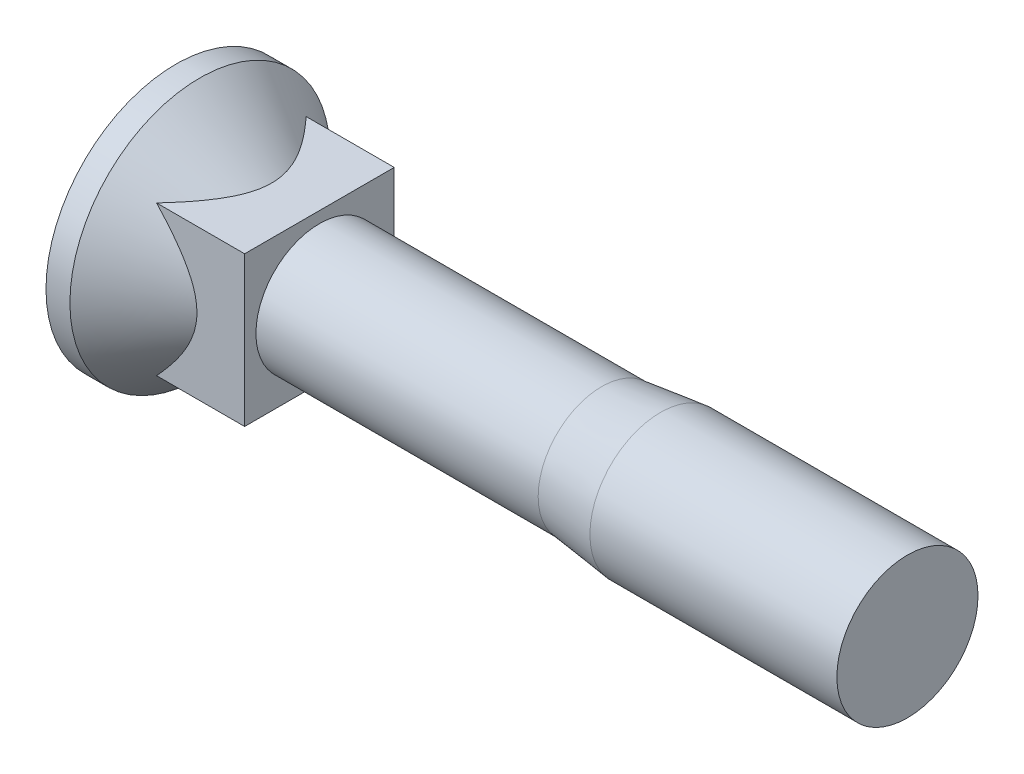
SolidWorks part; units mm, degrees
ref_plane "Front" through (0, 0, 0) normal (0, 0, 1) x (1, 0, 0)
ref_plane "Top" through (0, 0, 0) normal (0, 1, 0) x (1, 0, 0)
ref_plane "Right" through (0, 0, 0) normal (1, 0, 0) x (0, 0, -1)
ref_plane "Plane1" through (6.1, 0, 0) normal (1, 0, 0) x (0, 0, -1)
sketch "Sketch1" plane through (0, 0, 0) normal (0, 0, 1) x (1, 0, 0)
  line L0 (-5.3098, 0) -> (7.9048, 0) construction
  line L1 (0, 5.525) -> (0, 0)
  line L2 (0, 5.525) -> (1.0167, 5.525)
  line L3 (1.0167, 5.525) -> (7.5545, 0.5083)
  line L4 (7.5545, 0.5083) -> (7.5545, 0)
  line L5 (0, 0) -> (7.5545, 0)
  dimension "D1" = 37.5
  dimension "D2" = 1.0167
  dimension "D3" = 0.5083
  dimension "dk" = 11.05
revolve "BaseHead" add sketch "Sketch1" angle 360 about L0
sketch "Sketch2" plane through (6.1, 0, 0) normal (1, 0, 0) x (0, 0, -1)
  line L1 (3.18, -3.18) -> (3.18, 3.18)
  line L2 (3.18, 3.18) -> (-3.18, 3.18)
  line L3 (-3.18, 3.18) -> (-3.18, -3.18)
  line L4 (-3.18, -3.18) -> (3.18, -3.18)
  circle A0 centre (0, 0) radius 3.18 construction
  dimension "D1" = 6.36
  dimension "Ss" = 6.36
  dimension "D3" = 3.18
  dimension "D4" = 3.18
extrude "Neck" add sketch "Sketch2" against normal up to surface (6.1 mm away)
sketch "Sketch3" plane through (6.1, 0, 0) normal (1, 0, 0) x (0, 0, -1)
  circle A0 centre (0, 0) radius 3
  dimension "d" = 6
extrude "BaseBody" add sketch "Sketch3" along normal blind 25
sketch "Sketch4" plane through (0, 0, 0) normal (0, 1, 0) x (1, 0, 0)
  line L0 (-1.1729, 0) -> (32.1215, 0) construction
  line L2 (6.1, 2.7) -> (18.1, 2.7)
  line L3 (18.1, 2.7) -> (20.6, 3)
  line L4 (20.6, 3) -> (6.1, 3)
  line L5 (6.1, 3) -> (6.1, 2.7)
  line L6 (31.1, -3) -> (31.1, 3) construction
  line L7 (0, 5.525) -> (0, -5.525) construction
  dimension "D1" = 6
  dimension "D2" = 5.4
  dimension "D3" = 6.1
  dimension "X" = 2.5
  dimension "D4" = 10.5
revolve "Cut-Extrude1" cut sketch "Sketch4" angle 360 about L0
sketch "Sketch5" plane through (0, 0, 0) normal (0, 0, 1) x (1, 0, 0)
  line L0 (30.8293, 3) -> (31.1, 2.531)
  line L1 (31.3708, 3.5415) -> (31.3708, 3)
  line L2 (31.1, -3) -> (31.1, 3) construction
  line L3 (31.1, 2.531) -> (31.3708, 3)
  line L4 (30.8293, 3.5415) -> (30.8293, 3)
  line L5 (31.1, 0) -> (0, 0) construction
  line L6 (30.8293, 3.5415) -> (31.3708, 3.5415)
  line L8 (31.1, 3) -> (20.6, 3) construction
  dimension "D2" = 0.5415
revolve "Cut-Revolve10" [suppressed] cut sketch "Sketch5" angle 360 about L5
pattern_linear "LPattern10" [suppressed] count 16 spacing 0.6498 along (1, 0, 0)
equation "\"D4@Sketch2\" = \"Ss@Sketch2\" / 2"
equation "\"D3@Sketch2\" = \"D4@Sketch2\""
equation "\"D1@Sketch2\" = \"Ss@Sketch2\""
equation "\"D3@Sketch1\" = \"D2@Sketch1\" / 2"
equation "\"D2@Sketch1\" = \"k@Plane1\" / 6"
equation "\"D1@Sketch4\" = \"d@Sketch3\""
equation "\"D2@Sketch4\" =\"d@Sketch3\" * 0.9"
equation "\"D4@Sketch4\" = \"D1@ThreadCosmetic1\""
equation "\"D3@Sketch4\"=\"k@Plane1\""
equation "\"D2@Sketch5\" = (  \"d@Sketch3\" - \"D2@ThreadCosmetic1\" )  / 2"
equation "\"D3@LPattern10\" = \"D2@Sketch5\" * 1.2"
equation "\"D1@LPattern10\" = \"D1@ThreadCosmetic1\" / \"D3@LPattern10\""
